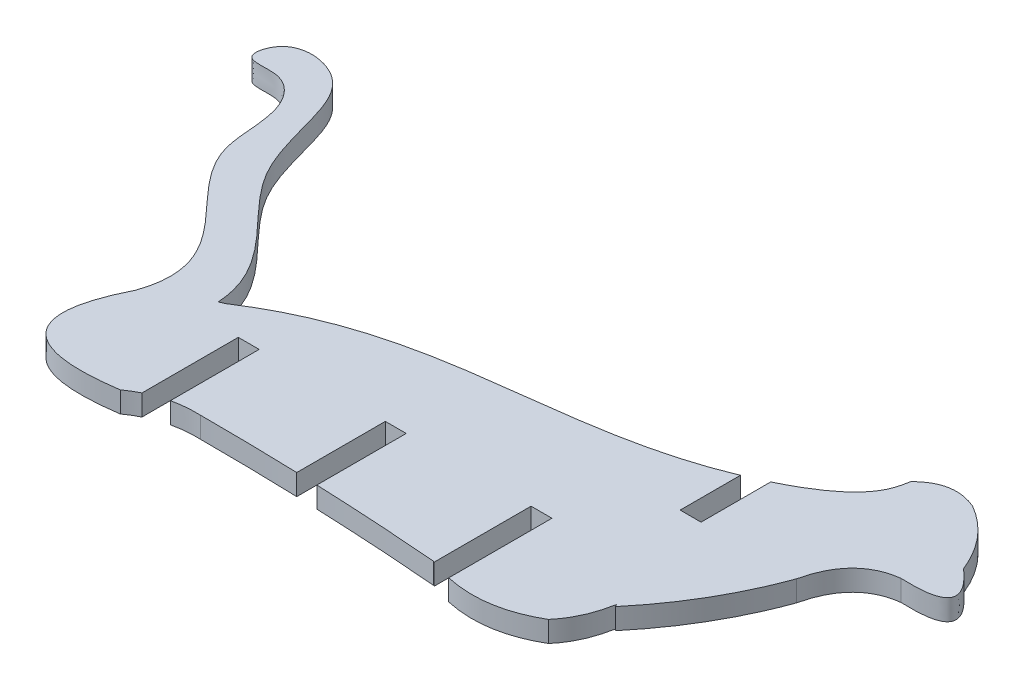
SolidWorks part; units mm, degrees
ref_plane "Alzado" through (0, 0, 0) normal (0, 0, 1) x (1, 0, 0)
ref_plane "Planta" through (0, 0, 0) normal (0, 1, 0) x (1, 0, 0)
ref_plane "Vista lateral" through (0, 0, 0) normal (1, 0, 0) x (0, 0, -1)
sketch "Croquis2" plane through (0, 0, 0) normal (0, 1, 0) x (1, 0, 0)
  line L0 (-20.4658, 19.6564) -> (39.7066, 19.6564) construction
  line L1 (55.0566, 13.5654) -> (55.2406, 13.232)
  line L19 (-5.2934, 19.6437) -> (-2.2934, 19.6437)
  line L20 (-5.2934, 19.6437) -> (-5.2934, 5.8226)
  line L22 (-2.2934, 19.6437) -> (-2.2934, 6.8949)
  line L24 (15.7066, 19.7494) -> (18.7066, 19.7494)
  line L25 (15.7066, 19.7494) -> (15.7066, 7.0318)
  line L27 (18.7066, 19.7494) -> (18.7066, 6.9231)
  line L28 (36.7066, 19.6674) -> (39.7066, 19.6674)
  line L29 (36.7066, 19.6674) -> (36.7066, 5.7706)
  line L31 (39.7066, 19.6674) -> (39.7066, 4.85)
  line L32 (50.8938, 39.8804) -> (50.8938, 29.8804)
  line L33 (50.8938, 29.8804) -> (47.8938, 29.8804)
  line L34 (47.8938, 38.5314) -> (47.8938, 29.8804)
  spline S0 degree 3 poles (-18.5169, 18.1508) (-14.5119, 29.5343) (-31.9797, 35.3708) (-29.7516, 50.7344) (-34.4462, 55.8402) (-40.1218, 54.408) (-38.5195, 60.8893) (-29.6521, 59.951) (-26.7789, 51.1562) (-23.5383, 37.4119) (-11.6464, 31.2635) (-11.1357, 22.6006) knots 0 0 0 0 0.276372 0.375367 0.426216 0.467018 0.496247 0.571538 0.655963 0.760229 1 1 1 1
  spline S1 degree 3 poles (-11.1357, 22.6006) (-10.8831, 22.7149) (-10.6292, 22.8267) (-10.3742, 22.9361) knots 0.550255 0.550255 0.550255 0.550255 0.571138 0.571138 0.571138 0.571138
  spline S2 degree 2 poles (68.4032, 51.3525) (64.0869, 53.2265) (60.9012, 49.9552) knots 0 0 0 1 1 1
  spline S3 degree 3 poles (-5.2934, 5.8226) (-5.9644, 5.4879) (-6.6112, 5.0949) (-7.2337, 4.6437) knots 0.757247 0.757247 0.757247 0.757247 1 1 1 1
  spline S4 degree 3 poles (36.5574, 5.8293) (30.6107, 6.3212) (24.6604, 6.6858) (18.7066, 6.9231) knots 0.259121 0.259121 0.259121 0.259121 0.638689 0.638689 0.638689 0.638689
  spline S5 degree 3 poles (60.9012, 49.9552) (60.7555, 49.095) (59.819, 44.9437) (54.8907, 41.8215) (50.8938, 39.8804) knots 0.191059 0.191059 0.191059 0.191059 0.219407 0.344529 0.344529 0.344529 0.344529
  spline S6 degree 2 poles (1.6945, 7.2544) (-0.4049, 7.3278) (-2.2934, 6.8949) knots 0 0 0 0.413123 0.413123 0.413123
  spline S7 degree 2 poles (-18.5169, 18.1508) (-26.7523, 1.7708) (-7.2337, 4.6437) knots 0 0 0 1 1 1
  spline S8 degree 2 poles (36.5574, 5.8293) (36.632, 5.7996) (36.7066, 5.7706) knots 0 0 0 0.009141 0.009141 0.009141
  spline S9 degree 3 poles (47.8938, 38.5314) (28.0082, 30.2806) (8.6356, 35.4977) (-10.3742, 22.9361) knots 0.375874 0.375874 0.375874 0.375874 1 1 1 1
  spline S12 degree 2 poles (55.0566, 13.5654) (54.3373, 9.5112) (52.0237, 6.8354) knots 0 0 0 0.509779 0.509779 0.509779
  spline S13 degree 3 poles (15.7066, 7.0318) (11.0381, 7.1843) (6.3674, 7.2585) (1.6945, 7.2544) knots 0.702434 0.702434 0.702434 0.702434 1 1 1 1
  spline S14 degree 3 poles (39.7066, 4.85) (44, 3.8925) (48.1057, 4.5544) (52.0237, 6.8354) knots 0.194812 0.194812 0.194812 0.194812 1 1 1 1
  spline S15 degree 2 poles (55.2406, 13.232) (61.5806, 20.7999) (64.7882, 29.7016) knots 0 0 0 0.729811 0.729811 0.729811
  spline S16 degree 2 poles (64.7882, 29.7016) (66.3459, 36.5102) (72.2314, 37.2479) knots 0 0 0 1 1 1
  spline S17 degree 2 poles (72.2314, 37.2479) (82.4737, 36.7986) (75.5268, 42.9268) knots 0 0 0 1 1 1
  spline S18 degree 2 poles (75.5268, 42.9268) (73.2926, 48.5011) (68.4032, 51.3525) knots 0 0 0 1 1 1
  spline S19 degree 2 poles (68.4032, 51.3525) (67.5534, 51.4435) (67.0674, 51.8163) knots 0 0 0 0.014408 0.014408 0.014408
  dimension "D1" = 18
  dimension "D2" = 18
  dimension "D3" = 3
extrude "Saliente-Extruir1" add sketch "Croquis2" along normal blind 3 contours S2 S5 L32 L33 L34 S9 S1 S0 S7 S3 L20 L19 L22 S6 S13 L25 L24 L27 S4 S8 L29 L28 L31 S14 S12 L1 S15 S16 S17 S18
